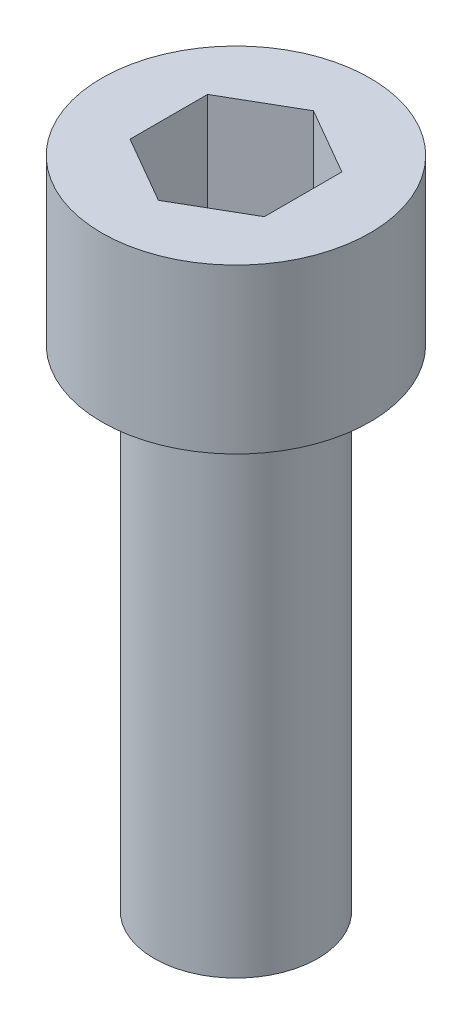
SolidWorks part; units mm, degrees
ref_plane "Front" through (0, 0, 0) normal (0, 0, 1) x (1, 0, 0)
ref_plane "Top" through (0, 0, 0) normal (0, 1, 0) x (1, 0, 0)
ref_plane "Right" through (0, 0, 0) normal (1, 0, 0) x (0, 0, -1)
sketch "Sketch1" plane through (0, 0, 0) normal (0, 0, 1) x (1, 0, 0)
  line L0 (0, 66.04) -> (0, -99.06) construction
  line L1 (0, 0) -> (-2.6035, 0)
  line L2 (-2.6035, 0) -> (-2.6035, -3.175)
  line L3 (-2.6035, -3.175) -> (-1.5875, -3.175)
  line L4 (-1.5875, -3.175) -> (-1.5875, -12.7)
  line L5 (-1.5875, -12.7) -> (0, -12.7)
  line L6 (0, 0) -> (0, -12.7)
  dimension "D1" = 5.207
  dimension "D2" = 3.175
  dimension "D3" = 3.175
  dimension "D4" = 9.525
revolve "Revolve1" add sketch "Sketch1" angle 360 about L0
sketch "Sketch2" plane through (0, 0, 0) normal (0, 1, 0) x (-1, 0, 0)
  line L0 (-10.16, 0) -> (12.7, 0) construction
  line L1 (0, -12.7) -> (0, 12.7) construction
  line L3 (0, -1.5045) -> (1.3029, -0.7522)
  line L4 (1.3029, -0.7522) -> (1.3029, 0.7522)
  line L5 (1.3029, 0.7522) -> (0, 1.5045)
  line L6 (0, 1.5045) -> (-1.3029, 0.7522)
  line L7 (-1.3029, 0.7522) -> (-1.3029, -0.7522)
  line L8 (-1.3029, -0.7522) -> (0, -1.5045)
  circle A0 centre (0, 0) radius 1.3029 construction
extrude "Cut-Extrude1" cut sketch "Sketch2" against normal blind 3.048
